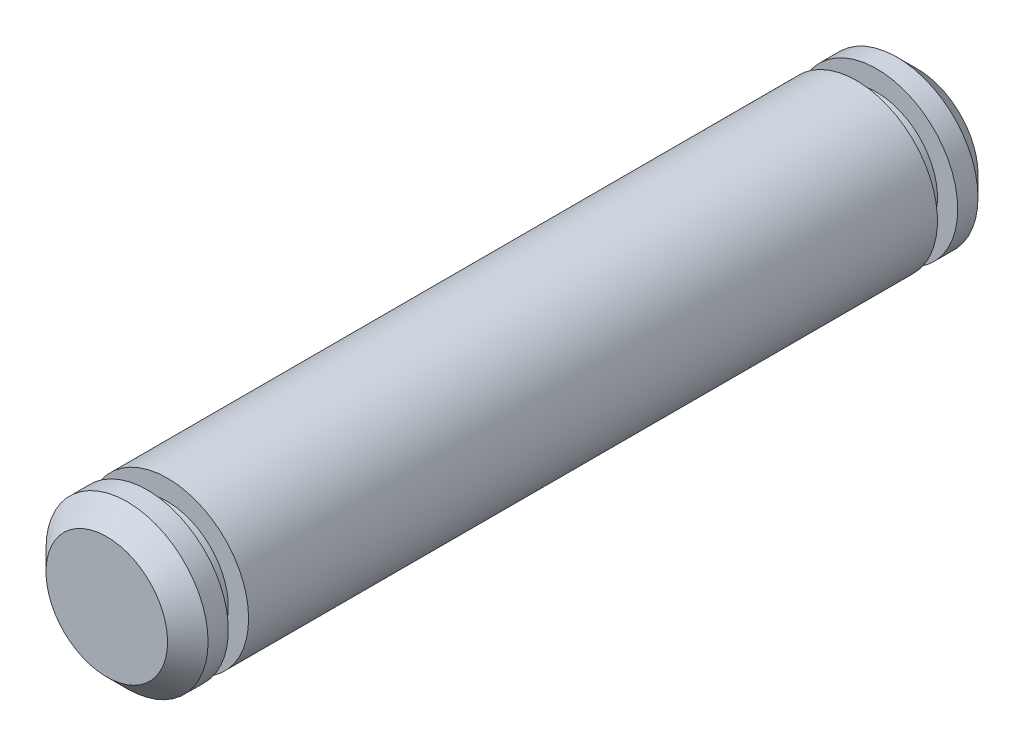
SolidWorks part; units mm, degrees
ref_plane "Plane1" through (0, 0, 0) normal (0, 0, 1) x (1, 0, 0)
ref_plane "Plane2" through (0, 0, 0) normal (0, 1, 0) x (1, 0, 0)
ref_plane "Plane3" through (0, 0, 0) normal (1, 0, 0) x (0, 0, -1)
sketch "Esquisse1" plane through (0, 0, 0) normal (0, 0, 1) x (1, 0, 0)
  circle A0 centre (0, 0) radius 4
  dimension "D1" = 8
extrude "Base-Extrusion" add sketch "Esquisse1" along normal blind 40
sketch "Esquisse2" plane through (0, 0, 0) normal (0, 1, 0) x (1, 0, 0)
  line L0 (-8, -2) -> (-3, -2)
  line L1 (-8, -2) -> (-8, -3)
  line L2 (-3, -3) -> (-8, -3)
  line L3 (-3, -3) -> (-3, -2)
  line L4 (4, 0) -> (-4, 0) construction
  line L5 (-4, 0) -> (-4, -40) construction
  line L6 (0, 3.3937) -> (0, -46.7356) construction
  line L7 (0, -90) -> (0, 10) construction
  dimension "D1" = 2
  dimension "D2" = 1
  dimension "D3" = 1
revolve "Enlever de la matière-Pivoter1" cut sketch "Esquisse2" angle 360 about L6
sketch "Esquisse3" plane through (0, 0, 0) normal (0, 1, 0) x (1, 0, 0)
  line L0 (-8, -37) -> (-3, -37)
  line L1 (-8, -37) -> (-8, -38)
  line L2 (-3, -38) -> (-8, -38)
  line L3 (-3, -38) -> (-3, -37)
  line L4 (4, -40) -> (-4, -40) construction
  line L5 (-4, -3) -> (-4, -40) construction
  line L6 (0, 3.5793) -> (0, -45.2503) construction
  line L7 (0, -90) -> (0, 10) construction
  dimension "D1" = 2
  dimension "D2" = 1
  dimension "D3" = 1
revolve "Enlever de la matière-Pivoter2" cut sketch "Esquisse3" angle 360 about L6
chamfer "Chanfrein1" distance 1 angle 45
